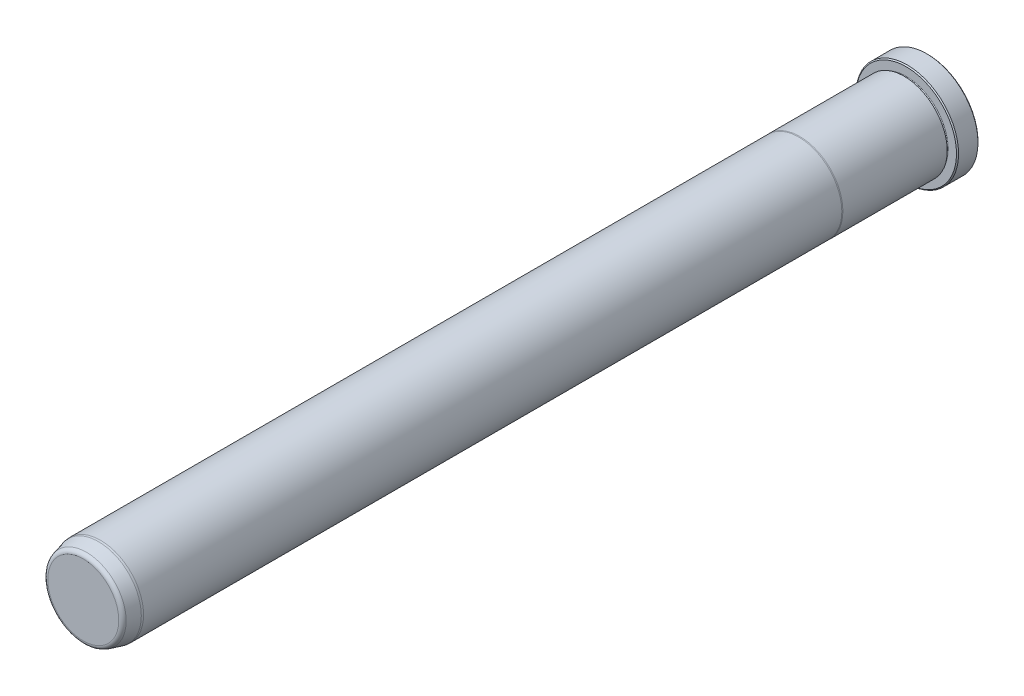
SolidWorks part; units mm, degrees
ref_plane "Front Plane" through (0, 0, 0) normal (0, 0, 1) x (1, 0, 0)
ref_plane "Top Plane" through (0, 0, 0) normal (0, 1, 0) x (1, 0, 0)
ref_plane "Right Plane" through (0, 0, 0) normal (1, 0, 0) x (0, 0, -1)
sketch "Sketch1" plane through (0, 0, 0) normal (1, 0, 0) x (0, 0, -1)
  line L0 (0, 0) -> (0, 18.923)
  line L1 (0, 18.923) -> (-7.9248, 18.923)
  line L2 (-7.9248, 18.923) -> (-7.9248, 15.4813)
  line L3 (-4.7498, 15.1003) -> (-5.5118, 15.1003) construction
  line L4 (-8.6868, 15.4813) -> (-8.6868, 15.8877)
  line L5 (-8.6868, 15.8877) -> (-47.1348, 15.8877)
  line L6 (-47.1348, 15.8877) -> (-47.498, 15.8623)
  line L7 (-47.498, 15.8623) -> (-304.8, 15.8623)
  line L9 (-311.15, 14.2983) -> (-311.15, 0)
  line L10 (-311.15, 0) -> (0, 0)
  line L11 (0, 0) -> (13.6287, 0) construction
  line L12 (-304.8, 15.8623) -> (-305.562, 15.7956)
  line L13 (-305.562, 15.7956) -> (-311.15, 14.2983)
  arc A0 (-8.6868, 15.4813) -> (-7.9248, 15.4813) centre (-8.3058, 15.4813) ccw
  dimension "D14" = 0.762
  dimension "D1" = 7.9248
  dimension "D2" = 0.762
  dimension "D3" = 37.846
  dimension "D4" = 31.7754
  dimension "D5" = 47.498
  dimension "D6" = 311.15
  dimension "D7" = 0.7874
  dimension "D8" = 4
  dimension "D9" = 31.7246
  dimension "D10" = 5
  dimension "D11" = 15
  dimension "D12" = 0.762
  dimension "D13" = 6.35
revolve "Revolve1" add sketch "Sketch1" angle 360 about L11
fillet "Fillet6" radius 1.5875 1 edges at (14.2983, 0, 311.15)
chamfer "Chamfer1" distance 0.381 angle 45 2 edges at (18.923, 0, 0) (18.923, 0, 7.9248)
